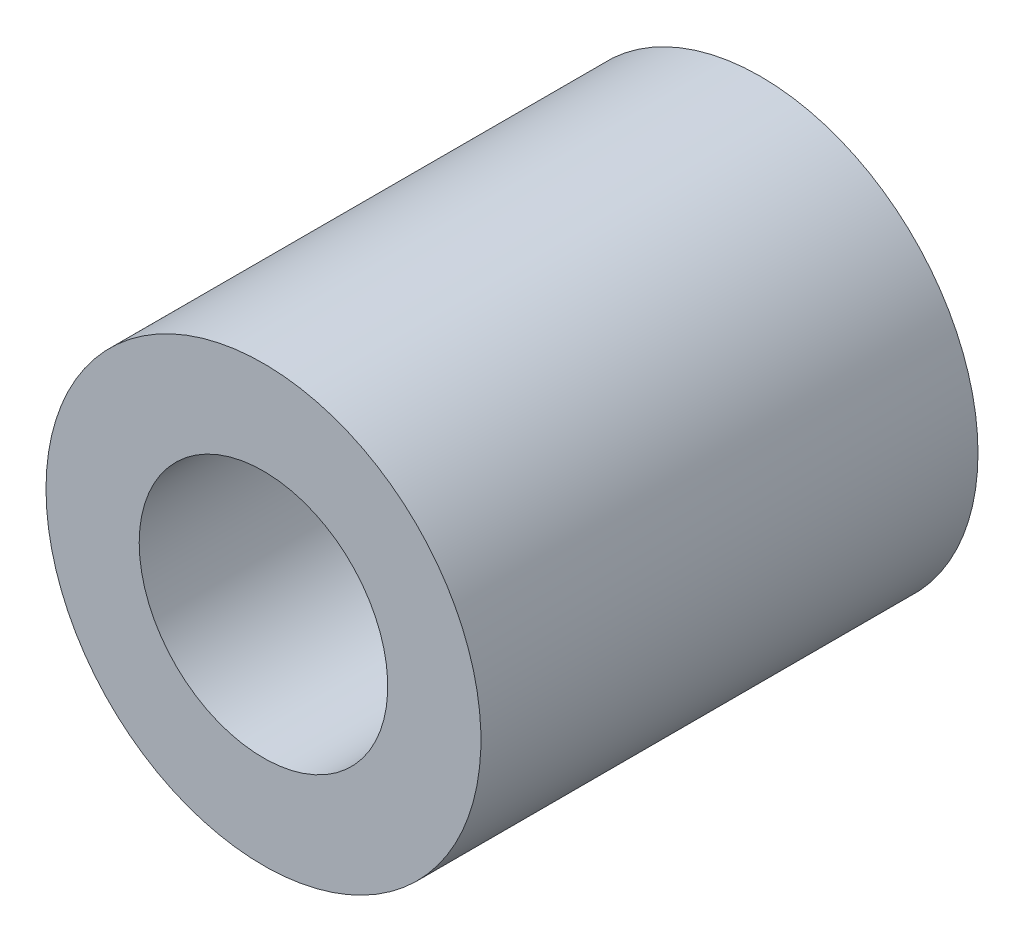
SolidWorks part; units mm, degrees
ref_plane "Plan de face" through (0, 0, 0) normal (0, 0, 1) x (1, 0, 0)
ref_plane "Plan de dessus" through (0, 0, 0) normal (0, 1, 0) x (1, 0, 0)
ref_plane "Plan de droite" through (0, 0, 0) normal (1, 0, 0) x (0, 0, -1)
sketch "Esquisse1" plane through (0, 0, 0) normal (0, 0, 1) x (1, 0, 0)
  circle A0 centre (-9.8229, 33.5933) radius 2 construction
  circle A1 centre (-9.8229, 33.5933) radius 2
  circle A2 centre (-9.8229, 33.5933) radius 3.5
  dimension "D1" = 7
extrude "Extrusion1" add sketch "Esquisse1" along normal up to surface (8 mm away)
